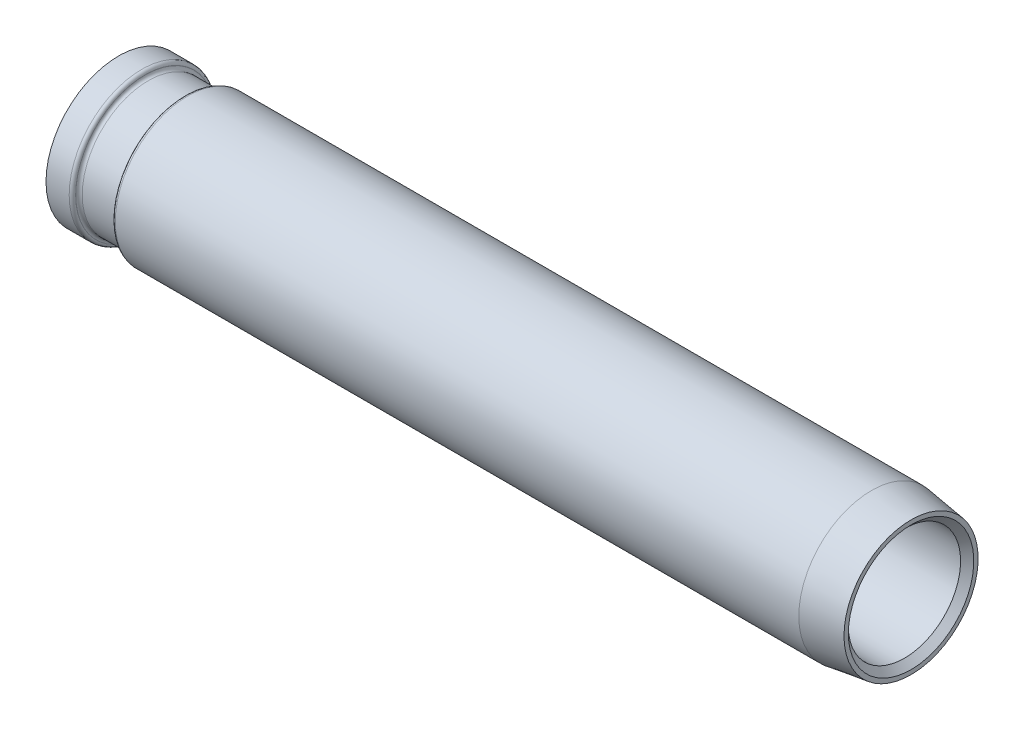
SolidWorks part; units mm, degrees
ref_plane "Plan de face" through (0, 0, 0) normal (0, 0, 1) x (1, 0, 0)
ref_plane "Plan de dessus" through (0, 0, 0) normal (0, 1, 0) x (1, 0, 0)
ref_plane "Plan de droite" through (0, 0, 0) normal (1, 0, 0) x (0, 0, -1)
sketch "Esquisse1" plane through (0, 0, 0) normal (0, 0, 1) x (1, 0, 0)
  line L0 (-100.0554, 0) -> (116.6684, 0) construction
  line L1 (-48.3475, 11) -> (-48.3475, 8.5)
  line L2 (71.6525, 11) -> (-37.8575, 11)
  line L3 (-38.3475, 10.51) -> (-38.3475, 10.49)
  line L4 (-38.8375, 10) -> (-43.8575, 10)
  line L5 (-44.3475, 10.51) -> (-44.3475, 10.49)
  line L6 (-48.3475, 11) -> (-44.8375, 11)
  line L7 (71.6525, 11) -> (71.6525, 8.5)
  line L8 (-48.3475, 8.5) -> (-44.8375, 8.5)
  line L9 (-43.8475, 7.5006) -> (-38.8375, 7.5006)
  line L10 (-38.3475, 7.9906) -> (-38.3475, 8)
  line L11 (-44.3475, 8.0006) -> (-44.3475, 8.01)
  line L12 (-37.8475, 8.5) -> (71.6525, 8.5)
  arc A0 (-37.8475, 8.5) -> (-38.3475, 8) centre (-37.8475, 8) ccw
  arc A1 (-44.3475, 8.0006) -> (-43.8475, 7.5006) centre (-43.8475, 8.0006) ccw
  arc A2 (-44.8375, 8.5) -> (-44.3475, 8.01) centre (-44.8375, 8.01) cw
  arc A3 (-38.3475, 7.9906) -> (-38.8375, 7.5006) centre (-38.8375, 7.9906) cw
  arc A4 (-38.3475, 10.49) -> (-38.8375, 10) centre (-38.8375, 10.49) cw
  arc A5 (-37.8575, 11) -> (-38.3475, 10.51) centre (-37.8575, 10.51) ccw
  arc A6 (-44.3475, 10.49) -> (-43.8575, 10) centre (-43.8575, 10.49) ccw
  arc A7 (-44.8375, 11) -> (-44.3475, 10.51) centre (-44.8375, 10.51) cw
  point P17 (-38.3475, 8.5)
  point P28 (-38.3475, 11)
  point P33 (-44.3475, 11)
  dimension "D8" = 0.5
  dimension "D9" = 0.49
  dimension "D1" = 110
  dimension "D2" = 120
  dimension "D3" = 17
  dimension "D4" = 22
  dimension "D5" = 22
  dimension "D6" = 20
  dimension "D7" = 4
revolve "Révolution2" add sketch "Esquisse1" angle 360 about L0
chamfer "Chanfrein3" distance 1 angle 45 2 edges at (-48.3475, 0, 8.5) (71.6525, 0, 8.5)
chamfer "Chanfrein5" distance 6 angle 8 1 edges at (71.6525, 0, 11)
